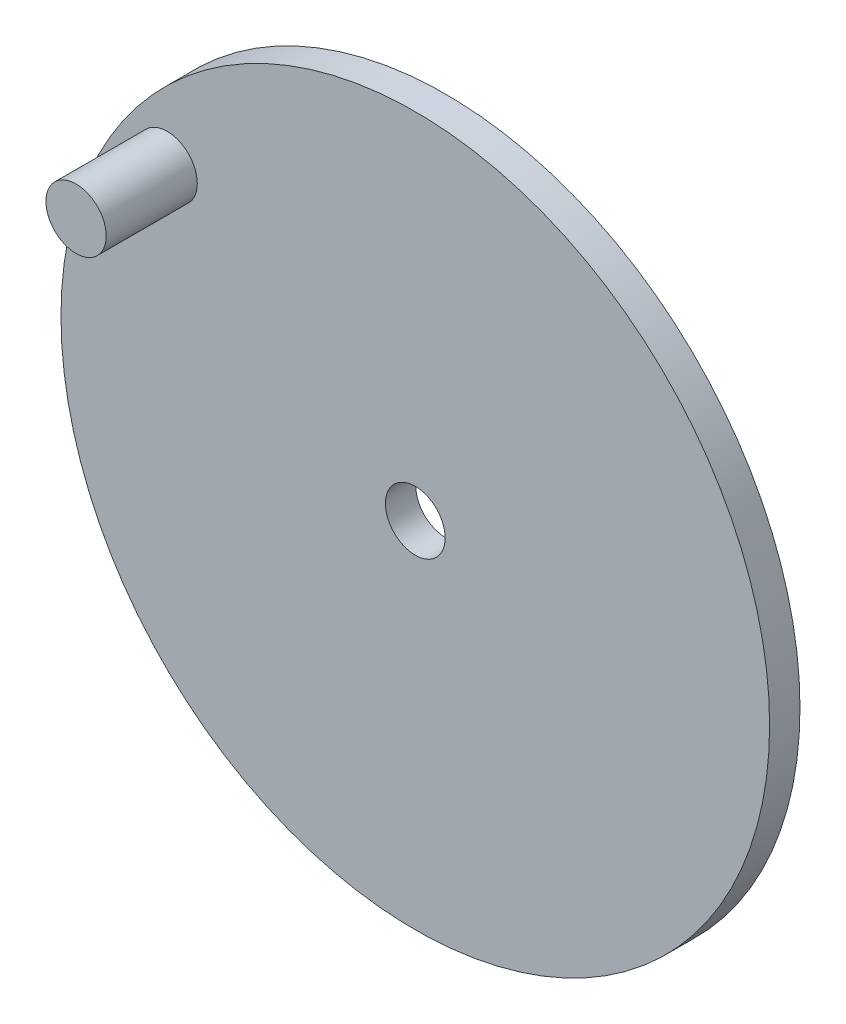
SolidWorks part; units mm, degrees
ref_plane "Front Plane" through (0, 0, 0) normal (0, 0, 1) x (1, 0, 0)
ref_plane "Top Plane" through (0, 0, 0) normal (0, 1, 0) x (1, 0, 0)
ref_plane "Right Plane" through (0, 0, 0) normal (1, 0, 0) x (0, 0, -1)
sketch "Sketch1" plane through (0, 0, 0) normal (0, 0, 1) x (1, 0, 0)
  circle A1 centre (0, 0) radius 35
  dimension "D1" = 70
extrude "Boss-Extrude3" add sketch "Sketch1" along normal blind 3 contours A1
sketch "Sketch6" plane through (0, 0, 3) normal (0, 0, 1) x (1, 0, 0)
  circle A0 centre (0, 0) radius 2.95
  dimension "D1" = 5.9
extrude "Cut-Extrude2" cut sketch "Sketch6" against normal up to surface (3 mm away)
sketch "Sketch9" plane through (0, 0, 0) normal (0, 0, 1) x (1, 0, 0)
  circle A0 centre (-24.5073, 18.0864) radius 2.975
  dimension "D1" = 5.95
extrude "Boss-Extrude4" add sketch "Sketch9" along normal blind 9 from surface at 3 separate body contours A0
